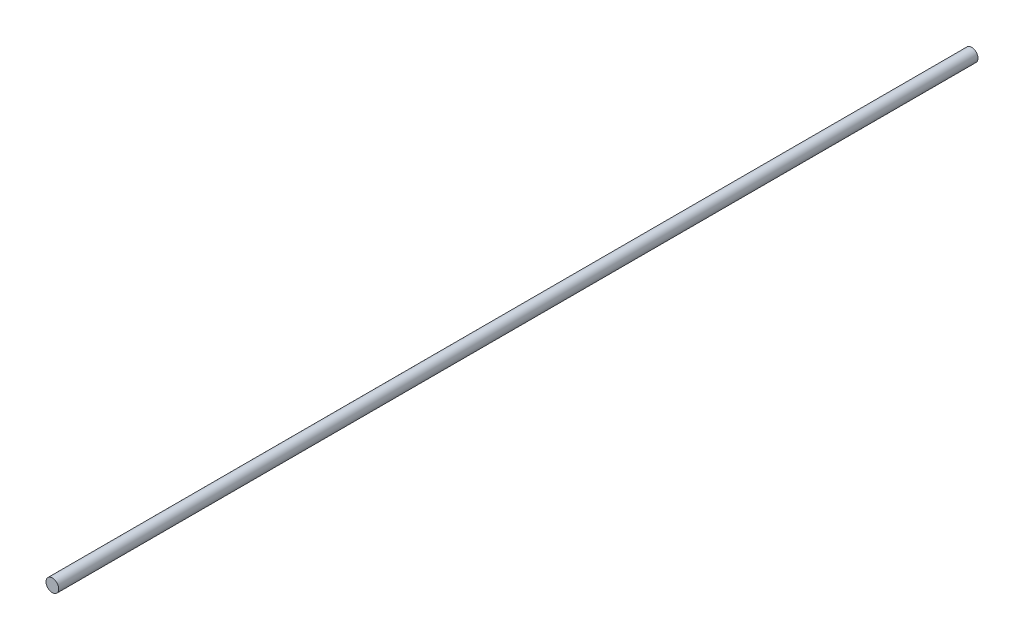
SolidWorks part; units mm, degrees
ref_plane "Plane1" through (0, 0, 0) normal (0, 0, 1) x (1, 0, 0)
ref_plane "Plane2" through (0, 0, 0) normal (0, 1, 0) x (1, 0, 0)
ref_plane "Plane3" through (0, 0, 0) normal (1, 0, 0) x (0, 0, -1)
sketch "Sketch1" plane through (0, 0, 0) normal (0, 0, 1) x (1, 0, 0)
  circle A0 centre (0, 0) radius 3.175
  dimension "D1" = 6.35
extrude "Base-Extrude" add sketch "Sketch1" along normal blind 457.2
